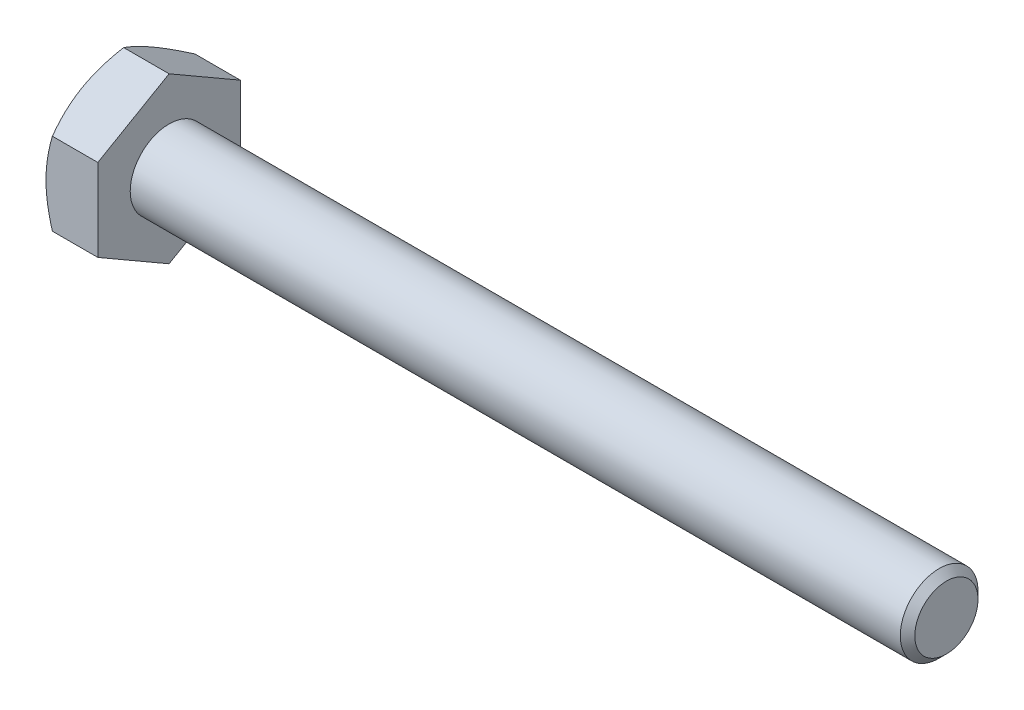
SolidWorks part; units mm, degrees
extrude "BaseHead" add sketch "Sketch1" along normal blind 2
sketch "Sketch1" plane through (0, 0, 0) normal (1, 0, 0) x (0, 0, -1)
  line L0 (2.75, 1.5877) -> (2.75, -1.5877)
  line L1 (-2.75, 1.5877) -> (-2.75, -1.5877)
  line L2 (2.75, -1.5877) -> (0, -3.1754)
  line L3 (0, -3.1754) -> (-2.75, -1.5877)
  line L4 (2.75, 1.5877) -> (0, 3.1754)
  line L5 (0, 3.1754) -> (-2.75, 1.5877)
ref_plane "Plane1" through (0, 0, 0) normal (0, 0, 1) x (1, 0, 0)
ref_plane "Plane2" through (0, 0, 0) normal (0, 1, 0) x (1, 0, 0)
ref_plane "Plane3" through (0, 0, 0) normal (1, 0, 0) x (0, 0, -1)
other "Configuration Table"
sketch "BodySke" plane through (0, 0, 0) normal (0, 0, 1) x (1, 0, 0)
  line L1 (0, 0) -> (32, 0)
  line L2 (0, 0) -> (0, 1.5)
  line L4 (32, 0) -> (32, 1.2195)
  line L5 (2, 3.1754) -> (2, 1.5877) construction
  line L6 (32, 1.2195) -> (31.7195, 1.5)
  line L7 (0, 0) -> (110.49, 0) construction
  line L8 (32, -1.2195) -> (31.7195, -1.5) construction
  line L9 (0, 1.5877) -> (0, -1.5877) construction
  line L10 (2.5, 15.24) -> (2.5, -1.27) construction
  line L11 (20, 15.24) -> (20, -1.27) construction
  line L12 (2, 1.5877) -> (2, -1.5877) construction
  line L15 (0, 1.5) -> (31.7195, 1.5)
revolve "BaseBody" add sketch "BodySke" angle 360 about L7
fillet "HeadFillet" [suppressed] radius 0.1
sketch "Sketch3" plane through (0, 0, 0) normal (0, 0, 1) x (1, 0, 0)
  line L0 (0, 2.75) -> (3.1324, 8.1754)
  line L1 (0, 3.1754) -> (0, 1.5877) construction
  line L2 (3.1324, 8.1754) -> (3.1324, 13.1754)
  line L3 (3.1324, 13.1754) -> (-10, 13.1754)
  line L4 (-10, 13.1754) -> (-10, 2.75)
  line L5 (-10, 2.75) -> (0, 2.75)
  line L6 (0, 0) -> (99.06, 0) construction
  line L7 (2, 3.1754) -> (0, 3.1754) construction
revolve "HeadChamfer" cut sketch "Sketch3" angle 360 about L6
sketch "ThdSchSke" plane through (0, 0, 0) normal (0, 0, 1) x (1, 0, 0)
  line L0 (20, -1.2195) -> (19.8036, -1.5)
  line L1 (20, -1.2195) -> (20.1964, -1.5)
  line L2 (20.1964, -1.5) -> (20.1964, -1.875)
  line L3 (-3.175, 0) -> (5.1513, 0) construction
  line L5 (20.1964, -1.875) -> (19.8036, -1.875)
  line L6 (19.8036, -1.875) -> (19.8036, -1.5)
revolve "ThreadSchematic" [suppressed] cut sketch "ThdSchSke" angle 360 about L3
pattern_linear "ThdSchPat" [suppressed]
equation "\"D3@Sketch1\" = \"Width_flats@Sketch1\" / 2"
equation "\"D4@Sketch1\" = \"D3@Sketch1\""
equation "\"D5@Sketch1\" = \"D4@Sketch1\""
equation "\"Thread_minor@ThreadCosmetic\" = \"Minor_dia@BodySke\""
equation "\"D1@Sketch3\" = \"Width_flats@Sketch1\" / 2"
equation "\"Thread_length@ThreadCosmetic\" = ((sgn( (\"Length@BodySke\" - \"Advance@BodySke\" ) - \"Thread_nom@BodySke\" )-1)*( (\"Length@BodySke\" - \"Advance@BodySke\" ) - \"Thread_nom@BodySke\" ))/-2+ \"Thread_nom@BodySke\""
equation "\"Thread_minor@ThdSchSke\" = \"Minor_dia@BodySke\""
equation "\"Diameter@ThdSchSke\" = \"Diameter@BodySke\""
equation "\"Overcut@ThdSchSke\" = \"Diameter@BodySke\" * 1.25"
equation "\"Start@ThdSchSke\" = \"Head_ht@BaseHead\" + \"Length@BodySke\" - \"Thread_length@ThreadCosmetic\"  '---Non-countersunk---"
equation "\"Num_threads@ThdSchPat\" = int( \"Thread_length@ThreadCosmetic\" / \"Advance@BodySke\" + 0.999 )  + 1"
equation "\"Advance@ThdSchPat\" = \"Thread_length@ThreadCosmetic\" /  (\"Num_threads@ThdSchPat\" - 1) 'relax it"
equation "\"Num_threads@ThdSchPat\" = \"Num_threads@ThdSchPat\" - sgn( \"Num_threads@ThdSchPat\" - 1) '---chamfered tips only---"
